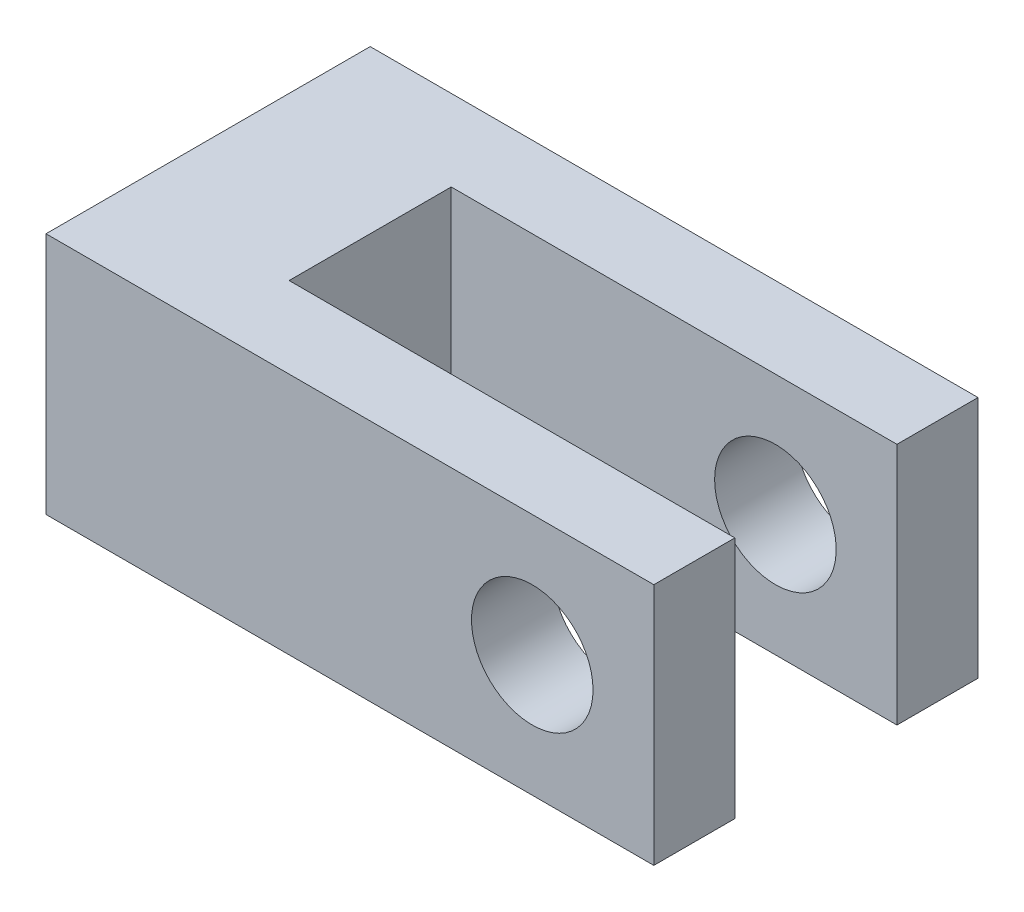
SolidWorks part; units mm, degrees
ref_plane "Front" through (0, 0, 0) normal (0, 0, 1) x (1, 0, 0)
ref_plane "Top" through (0, 0, 0) normal (0, 1, 0) x (1, 0, 0)
ref_plane "Right" through (0, 0, 0) normal (1, 0, 0) x (0, 0, -1)
sketch "Sketch1" plane through (0, 0, 0) normal (0, 0, 1) x (1, 0, 0)
  line L0 (-38.1, 0) -> (9.525, 0) construction
  line L1 (-38.1, 9.525) -> (9.525, 9.525)
  line L2 (-38.1, 9.525) -> (-38.1, -9.525)
  line L3 (-38.1, -9.525) -> (9.525, -9.525)
  line L4 (9.525, 9.525) -> (9.525, -9.525)
  circle A0 centre (0, 0) radius 4.7625
  dimension "D1" = 9.525
  dimension "D2" = 38.1
  dimension "D3" = 9.525
  dimension "D4" = 9.525
extrude "Boss-Extrude1" add sketch "Sketch1" along normal blind 25.4
sketch "Sketch2" plane through (0, 9.525, 0) normal (0, 1, 0) x (1, 0, 0)
  line L0 (9.525, -25.4) -> (9.525, 0) construction
  line L1 (9.525, -6.35) -> (-25.4, -6.35)
  line L2 (9.525, -6.35) -> (9.525, -19.05)
  line L3 (9.525, -19.05) -> (-25.4, -19.05)
  line L4 (-25.4, -6.35) -> (-25.4, -19.05)
  line L5 (-38.1, -25.4) -> (-38.1, 0) construction
  line L6 (-38.1, -12.7) -> (9.525, -12.7) construction
  point P10 (-25.4, -12.7)
  dimension "D1" = 12.7
  dimension "D2" = 12.7
extrude "Cut-Extrude1" cut sketch "Sketch2" against normal through all
sketch "Sketch3" plane through (-38.1, 0, 0) normal (-1, 0, 0) x (0, 0, 1)
  line L0 (0, 9.525) -> (25.4, -9.525) construction
  line L1 (25.4, 9.525) -> (0, -9.525) construction
  circle A0 centre (12.7, 0) radius 0.254
  point P8 (12.7, 0)
extrude "Cut-Extrude2" cut sketch "Sketch3" against normal through all
